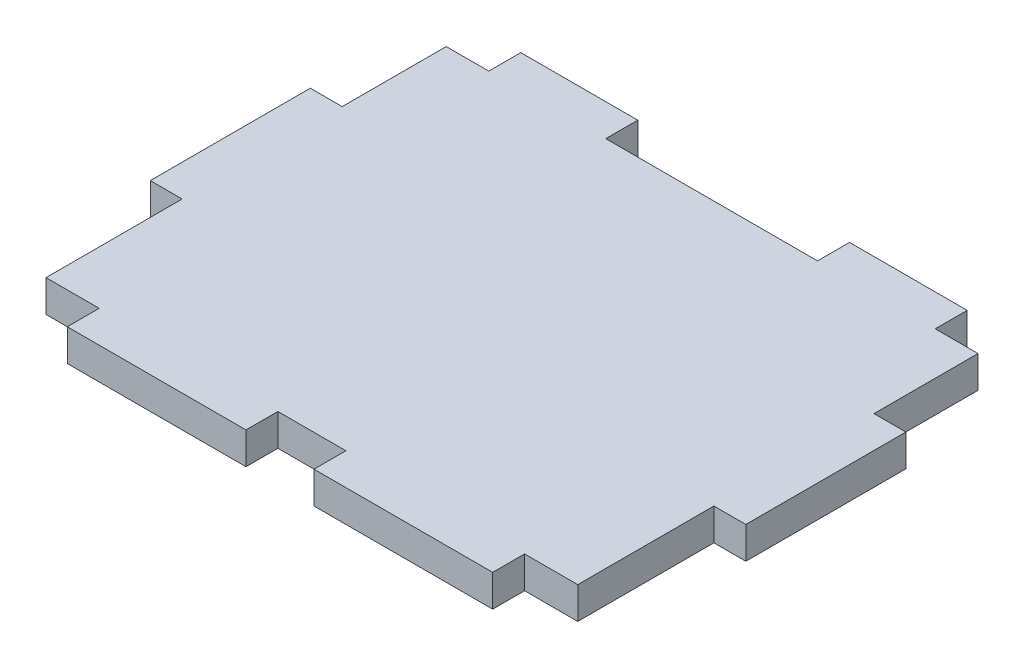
SolidWorks part; units mm, degrees
ref_plane "Спереди" through (0, 0, 0) normal (0, 0, 1) x (1, 0, 0)
ref_plane "Сверху" through (0, 0, 0) normal (0, 1, 0) x (1, 0, 0)
ref_plane "Справа" through (0, 0, 0) normal (1, 0, 0) x (0, 0, -1)
sketch "Эскиз1" plane through (0, 0, 0) normal (0, 1, 0) x (1, 0, 0)
  line L0 (-874.4378, 462.2772) -> (-874.4378, 472.0596)
  line L1 (-919.4378, 431.4249) -> (-902.6355, 431.4249)
  line L2 (-927.4378, 447.2275) -> (-927.4378, 462.2772)
  line L3 (-924.4378, 462.2772) -> (-924.4378, 472.0596)
  line L4 (-871.4378, 447.2275) -> (-871.4378, 462.2772)
  line L5 (-874.4378, 462.2772) -> (-871.4378, 462.2772)
  line L6 (-924.4378, 472.0596) -> (-920.4378, 472.0596)
  line L7 (-924.4378, 462.2772) -> (-927.4378, 462.2772)
  line L8 (-927.4378, 447.2275) -> (-924.4378, 447.2275)
  line L9 (-924.4378, 447.2275) -> (-924.4378, 434.4249)
  line L10 (-871.4378, 447.2275) -> (-874.4378, 447.2275)
  line L11 (-874.4378, 447.2275) -> (-874.4378, 434.4249)
  line L12 (-924.4378, 434.4249) -> (-919.4378, 434.4249)
  line L13 (-919.4378, 434.4249) -> (-919.4378, 431.4249)
  line L14 (-902.6355, 431.4249) -> (-902.6355, 434.4249)
  line L15 (-902.6355, 434.4249) -> (-896.2401, 434.4249)
  line L16 (-896.2401, 434.4249) -> (-896.2401, 431.4249)
  line L17 (-879.4378, 431.4249) -> (-879.4378, 434.4249)
  line L18 (-879.4378, 434.4249) -> (-874.4378, 434.4249)
  line L19 (-896.2401, 431.4249) -> (-879.4378, 431.4249)
  line L20 (-920.4378, 472.0596) -> (-920.4378, 475.0695)
  line L21 (-909.4378, 472.0596) -> (-889.5275, 472.0596)
  line L22 (-920.4378, 475.0695) -> (-909.4378, 475.0695)
  line L23 (-878.4628, 475.0695) -> (-889.5275, 475.0695)
  line L24 (-909.4378, 475.0695) -> (-909.4378, 472.0596)
  line L25 (-889.5275, 475.0695) -> (-889.5275, 472.0596)
  line L26 (-874.4378, 472.0596) -> (-878.4628, 472.0596)
  line L27 (-878.4628, 472.0596) -> (-878.4628, 475.0695)
extrude "Бобышка-Вытянуть1" add sketch "Эскиз1" along normal blind 3
